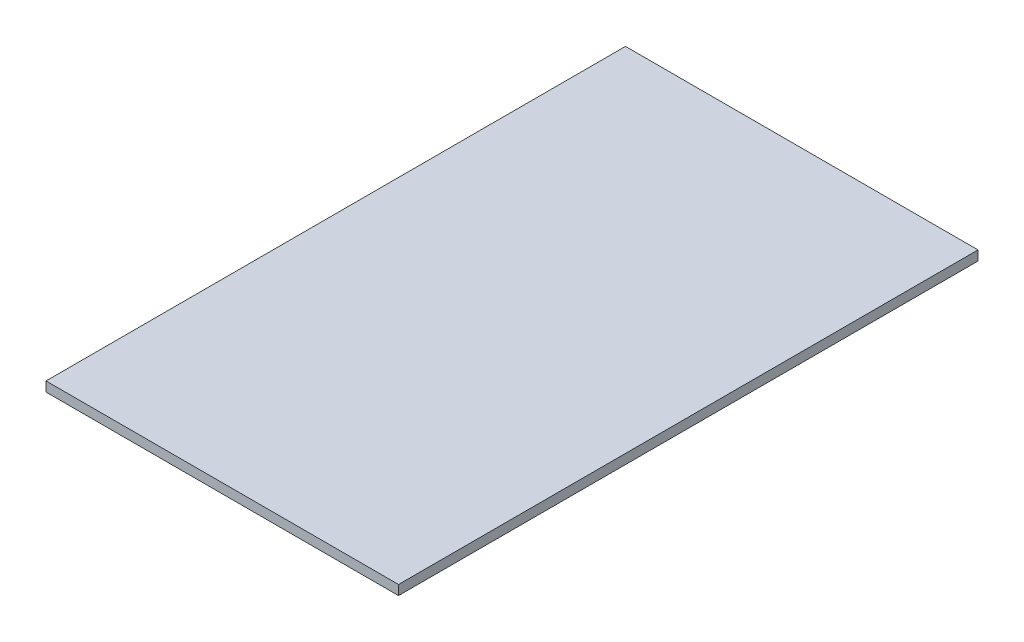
SolidWorks part; units mm, degrees
ref_plane "Front" through (0, 0, 0) normal (0, 0, 1) x (1, 0, 0)
ref_plane "Top" through (0, 0, 0) normal (0, 1, 0) x (1, 0, 0)
ref_plane "Right" through (0, 0, 0) normal (1, 0, 0) x (0, 0, -1)
sketch "Sketch1" plane through (0, 0, 0) normal (0, 1, 0) x (1, 0, 0)
  line L1 (0, 0) -> (927.1, 0)
  line L2 (0, 0) -> (0, 1524)
  line L3 (0, 1524) -> (927.1, 1524)
  line L4 (927.1, 0) -> (927.1, 1524)
  dimension "D1" = 1524
  dimension "D2" = 927.1
extrude "Boss-Extrude1" add sketch "Sketch1" along normal blind 25.4
